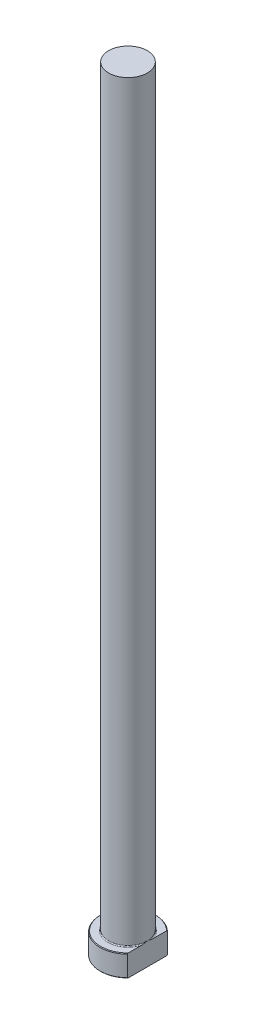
SolidWorks part; units mm, degrees
ref_plane "Front Plane" through (0, 0, 0) normal (0, 0, 1) x (1, 0, 0)
ref_plane "Top Plane" through (0, 0, 0) normal (0, 1, 0) x (1, 0, 0)
ref_plane "Right Plane" through (0, 0, 0) normal (1, 0, 0) x (0, 0, -1)
sketch "Sketch1" plane through (0, 0, 0) normal (0, 0, 1) x (1, 0, 0)
  line L0 (0, 259.9588) -> (0, -15.1925) construction
  line L1 (0, 0) -> (-9, 0)
  line L2 (-9, 0) -> (-9, 7)
  line L3 (-9, 7) -> (-6.25, 7)
  line L4 (-6.25, 7) -> (-6.25, 250)
  line L5 (-6.25, 250) -> (0, 250)
  line L6 (0, 250) -> (0, 0)
  dimension "L" = 250
  dimension "H" = 18
  dimension "T" = 7
  dimension "D" = 12.5
revolve "Revolve1" add sketch "Sketch1" angle 360 about L0
chamfer "Chamfer1" distance 0.2 angle 45 2 edges at (0, 7, 9) (0, 0, 9)
fillet "Fillet1" radius 0.3 1 edges at (0, 7, 6.25)
sketch "Sketch2" plane through (0, 0, 0) normal (0, 1, 0) x (1, 0, 0)
  line L0 (6.25, 6.4759) -> (6.25, -6.4759)
  circle A0 centre (0, 0) radius 9 construction
  arc A1 (6.25, -6.4759) -> (6.25, 6.4759) centre (0, 0) ccw
  circle A2 centre (0, 0) radius 6.25 construction
extrude "KEY" cut sketch "Sketch2" along normal through all
